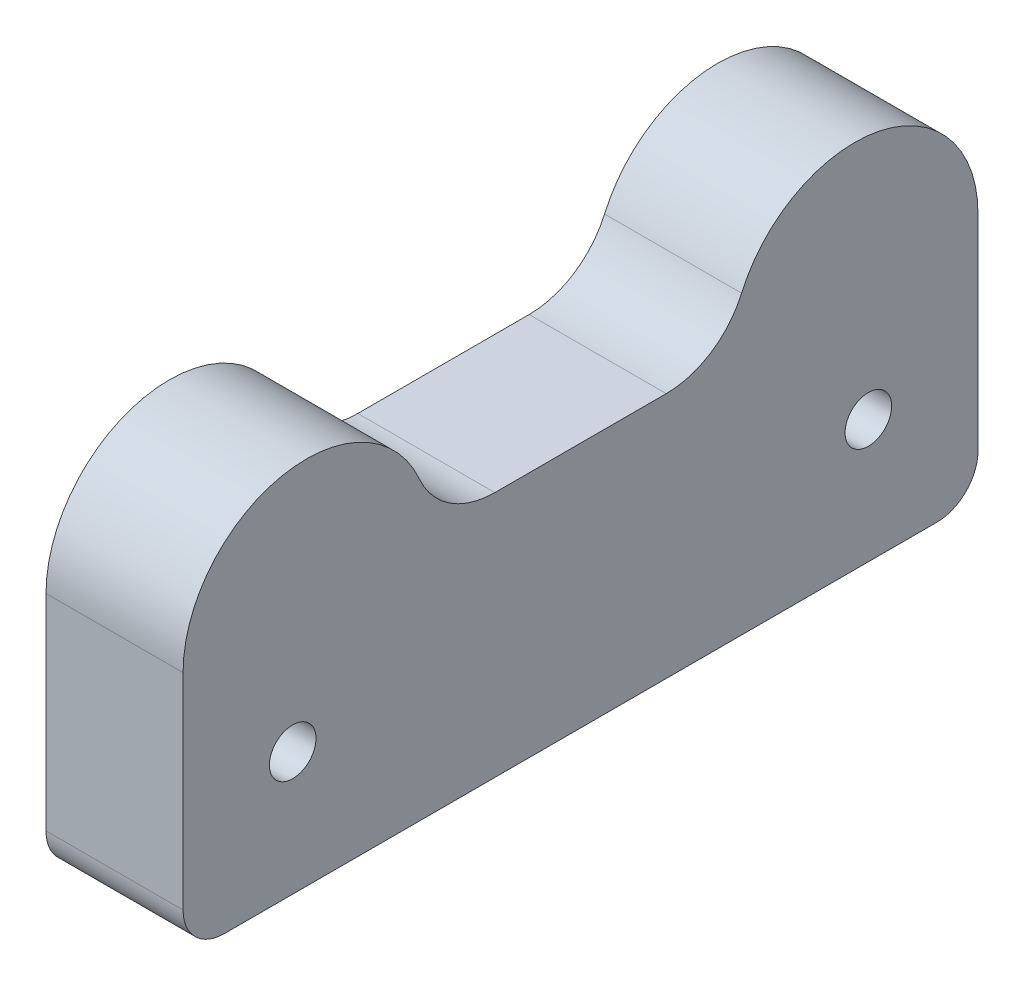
SolidWorks part; units mm, degrees
ref_plane "Front Plane" through (0, 0, 0) normal (0, 0, 1) x (1, 0, 0)
ref_plane "Top Plane" through (0, 0, 0) normal (0, 1, 0) x (1, 0, 0)
ref_plane "Right Plane" through (0, 0, 0) normal (1, 0, 0) x (0, 0, -1)
sketch "Sketch4" plane through (0, 0, 0) normal (1, 0, 0) x (0, 0, -1)
  line L1 (0, 0) -> (58, 0)
  line L2 (0, 0) -> (0, 18)
  line L3 (0, 18) -> (58, 18)
  line L4 (58, 0) -> (58, 18)
  dimension "D1" = 58
  dimension "D2" = 18
extrude "Boss-Extrude1" add sketch "Sketch4" along normal blind 10
sketch "Sketch5" plane through (10, 0, 0) normal (1, 0, 0) x (0, 0, -1)
  line L0 (58, 18) -> (0, 18) construction
  line L1 (0, 18) -> (0, 0) construction
  line L2 (58, 0) -> (58, 18) construction
  circle A0 centre (9, 18) radius 9
  circle A1 centre (49, 18) radius 9
  dimension "D1" = 18
  dimension "D2" = 18
extrude "Boss-Extrude2" add sketch "Sketch5" against normal blind 10
sketch "Sketch6" plane through (10, 0, 0) normal (1, 0, 0) x (0, 0, -1)
  line L0 (0, 18) -> (0, 0) construction
  line L1 (0, 0) -> (58, 0) construction
  circle A0 centre (8, 9) radius 1.7
  circle A1 centre (50, 9) radius 1.7
  dimension "D1" = 3.4
  dimension "D2" = 3.4
  dimension "D3" = 42
  dimension "D4" = 8
  dimension "D5" = 9
  dimension "D6" = 9
extrude "Cut-Extrude1" cut sketch "Sketch6" against normal through all
fillet "Fillet1" radius 3 2 edges at (5, 0, -58) (5, 0, 0)
fillet "Fillet2" radius 6 2 edges at (5, 18, -40) (5, 18, -18)
